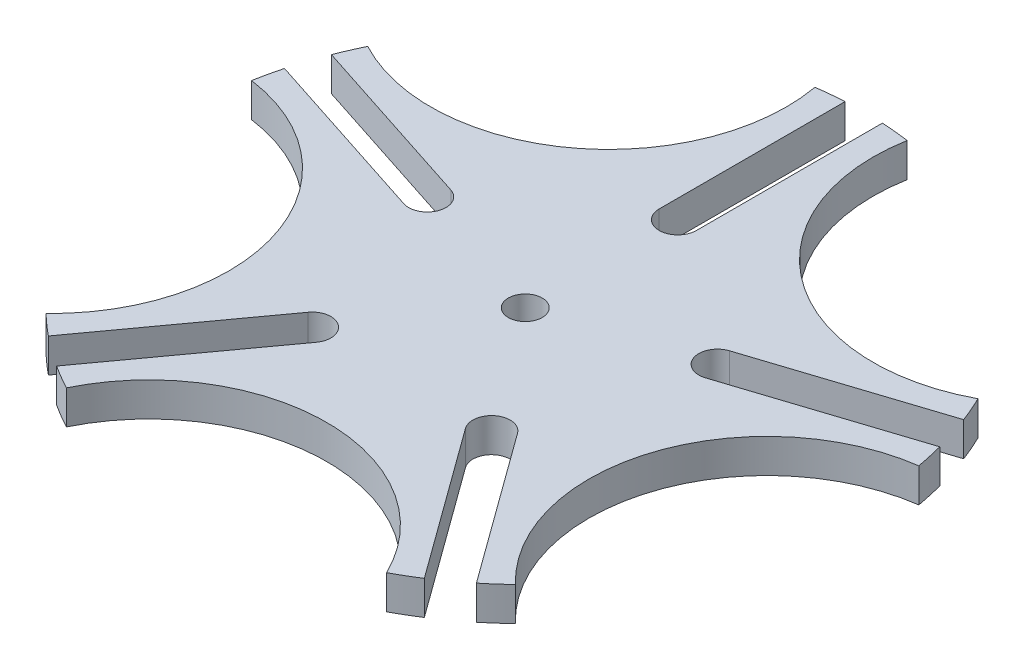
SolidWorks part; units mm, degrees
ref_plane "Front Plane" through (0, 0, 0) normal (0, 0, 1) x (1, 0, 0)
ref_plane "Top Plane" through (0, 0, 0) normal (0, 1, 0) x (1, 0, 0)
ref_plane "Right Plane" through (0, 0, 0) normal (1, 0, 0) x (0, 0, -1)
sketch "Sketch1" plane through (0, 0, 0) normal (0, 1, 0) x (1, 0, 0)
  line L17 (0, 0) -> (105.6946, 145.4761) construction
  point P5 (26.4503, 36.4058)
  point P62 (42.6144, -58.6537)
  point P69 (-42.6144, -58.6537)
  point P76 (68.9516, 22.4037)
  line B0 (0, 45) -> (0, 100) construction
  line B1 (0, 45) -> (0, 100) construction
  line B2 (-5.5, 45) -> (-5.5, 100)
  line B3 (5.5, 45) -> (5.5, 100)
  line B4 (42.7975, 13.9058) -> (95.1057, 30.9017) construction
  line B5 (41.0979, 19.1366) -> (93.4061, 36.1325)
  line B6 (44.4971, 8.675) -> (96.8052, 25.6709)
  line B7 (26.4503, -36.4058) -> (58.7785, -80.9017) construction
  line B8 (30.8999, -33.1729) -> (63.2281, -77.6689)
  line B9 (22.0007, -39.6386) -> (54.24, -84.0121)
  line B10 (-26.4503, -36.4058) -> (-58.7785, -80.9017) construction
  line B11 (-22.0007, -39.6386) -> (-54.3289, -84.1345)
  line B12 (-30.8999, -33.1729) -> (-63.2281, -77.6689)
  line B13 (-42.7975, 13.9058) -> (-95.1057, 30.9017) construction
  line B14 (-44.4971, 8.675) -> (-96.8052, 25.6709)
  line B15 (-41.0979, 19.1366) -> (-93.4061, 36.1325)
  line B16 (95.1057, 30.9017) -> (0, 100) construction
  circle B17 centre (0, 0) radius 45 construction
  circle B18 centre (0, 0) radius 5
  arc B19 (13.5988, 99.071) -> (5.5, 99.8486) centre (0, 0) ccw
  arc B20 (-5.5, 45) -> (5.5, 45) centre (0, 45) ccw
  arc B21 (-5.5, 99.8486) -> (-13.5988, 99.071) centre (0, 0) ccw
  arc B22 (41.0979, 19.1366) -> (44.4971, 8.675) centre (42.7975, 13.9058) ccw
  arc B23 (-96.6613, 25.6241) -> (-98.4244, 17.6814) centre (0, 0) ccw
  arc B24 (30.8999, -33.1729) -> (22.0007, -39.6386) centre (26.4503, -36.4058) ccw
  arc B25 (-22.0007, -39.6386) -> (-30.8999, -33.1729) centre (-26.4503, -36.4058) ccw
  arc B26 (-44.4971, 8.675) -> (-41.0979, 19.1366) centre (-42.7975, 13.9058) ccw
  arc B27 (13.5988, 99.071) -> (90.0199, 43.5479) centre (65.2836, 89.8552) ccw
  arc B28 (98.4244, 17.6814) -> (69.2342, -72.157) centre (105.6312, -34.3216) ccw
  arc B29 (47.2308, -88.1434) -> (-47.2308, -88.1434) centre (0, -111.0672) ccw
  arc B30 (-69.2342, -72.157) -> (-98.4244, 17.6814) centre (-105.6312, -34.3216) ccw
  arc B31 (-90.0199, 43.5479) -> (-13.5988, 99.071) centre (-65.2836, 89.8552) ccw
  arc B32 (-69.2342, -72.157) -> (-63.1391, -77.5464) centre (0, 0) ccw
  arc B33 (-90.0199, 43.5479) -> (-93.2621, 36.0857) centre (0, 0) ccw
  arc B34 (47.2308, -88.1434) -> (54.24, -84.0121) centre (0, 0) ccw
  arc B35 (98.4244, 17.6814) -> (96.6613, 25.6241) centre (0, 0) ccw
  arc B36 (63.1391, -77.5464) -> (69.2342, -72.157) centre (0, 0) ccw
  arc B37 (-54.24, -84.0121) -> (-47.2308, -88.1434) centre (0, 0) ccw
  arc B38 (93.2621, 36.0857) -> (90.0199, 43.5479) centre (0, 0) ccw
  circle B39 centre (65.2836, 89.8552) radius 71.5069
  circle B40 centre (65.2836, 89.8552) radius 5
  arc B41 (90.241, 44.2358) -> (14.1848, 99.4939) centre (65.2836, 89.8552) ccw
  circle B42 centre (26.4503, 36.4058) radius 5
  arc B43 (90.241, 44.2358) -> (14.1848, 99.4939) centre (0, 0) ccw
  circle B44 centre (65.2836, 89.8552) radius 66.0672 construction
sketch_block_instance "Block1-1"
sketch_block "Block1" parameters "D1"=200, "D2"=90, "D3"=10, "D5"=105, "D4"=11
sketch_block_instance "Block2-1"
sketch_block "Block2" parameters "D1"=10, "D2"=104, "D3"=10
extrude "Boss-Extrude1" add sketch "Sketch1" along normal blind 10
